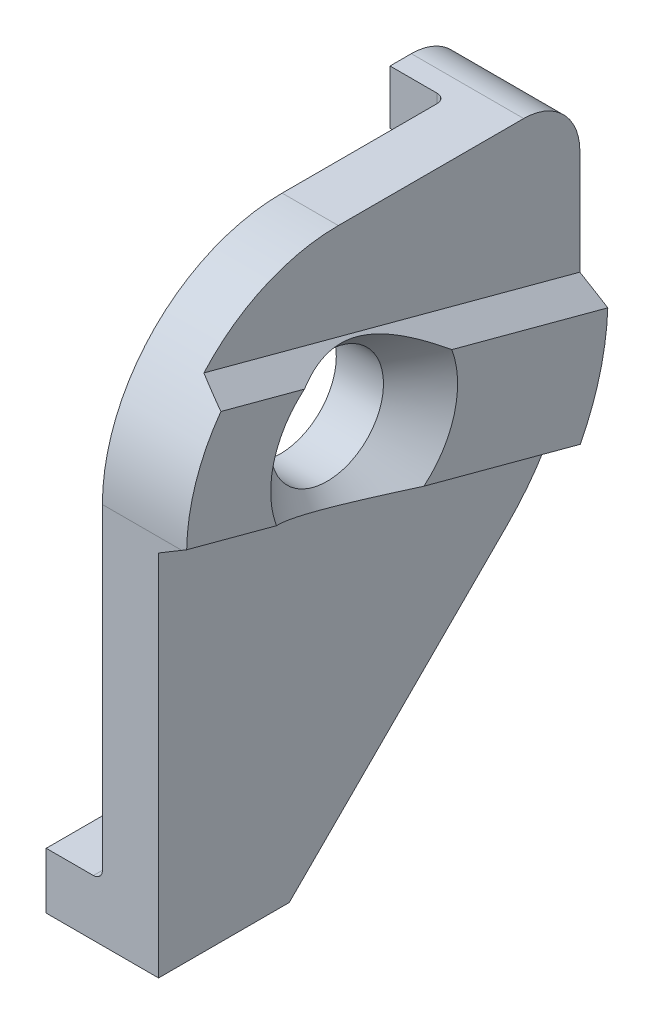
SolidWorks part; units mm, degrees
ref_plane "Спереди" through (0, 0, 0) normal (0, 0, 1) x (1, 0, 0)
ref_plane "Сверху" through (0, 0, 0) normal (0, 1, 0) x (1, 0, 0)
ref_plane "Справа" through (0, 0, 0) normal (1, 0, 0) x (0, 0, -1)
sketch "Эскиз1" plane through (0, 0, 0) normal (1, 0, 0) x (0, 0, -1)
  line L0 (-10.033, -22.225) -> (-10.033, -0.635)
  line L1 (0.127, 9.525) -> (10.6045, 9.525)
  line L2 (13.7795, 6.35) -> (13.7795, -0.0109)
  line L3 (9.6878, -9.8892) -> (-2.648, -22.225)
  line L4 (-2.648, -22.225) -> (-10.033, -22.225)
  circle A0 centre (0, 0) radius 3.1877
  arc A1 (-10.033, -0.635) -> (0.127, 9.525) centre (0.127, -0.635) cw
  arc A2 (13.7795, -0.0109) -> (9.6878, -9.8892) centre (-0.1905, -0.0109) cw
  arc A3 (10.6045, 9.525) -> (13.7795, 6.35) centre (10.6045, 6.35) cw
  dimension "D2" = 6.3754
  dimension "D7" = 10.16
  dimension "D8" = 13.97
  dimension "D10" = 3.175
  dimension "D1" = 10.033
  dimension "D3" = 45
  dimension "D4" = 23.8125
  dimension "D5" = 9.525
  dimension "D6" = 31.75
  dimension "D9" = 13.843
extrude "Бобышка-Вытянуть1" add sketch "Эскиз1" along normal blind 3.175
sketch "Эскиз2" plane through (0, 0, 0) normal (-1, 0, 0) x (0, 0, 1)
  line L0 (-10.6045, 9.525) -> (-0.127, 9.525) construction
  line L1 (-9.398, 6.477) -> (-13.777, 6.477)
  line L2 (-9.398, 6.477) -> (-9.398, 9.525)
  line L3 (-9.398, 9.525) -> (-10.6045, 9.525)
  line L5 (10.033, -22.225) -> (6.477, -22.225)
  line L6 (10.033, -22.225) -> (10.033, -19.05)
  line L7 (10.033, -19.05) -> (6.477, -19.05)
  line L8 (6.477, -22.225) -> (6.477, -19.05)
  arc A0 (-10.6045, 9.525) -> (-13.777, 6.477) centre (-10.6045, 6.35) ccw
  arc A1 (-10.6045, 9.525) -> (-13.7795, 6.35) centre (-10.6045, 6.35) ccw construction
  dimension "D2" = 15.875
  dimension "D3" = 6.477
  dimension "D4" = 19.05
  dimension "D5" = 6.477
extrude "Бобышка-Вытянуть2" add sketch "Эскиз2" along normal blind 3.175
fillet "Скругление1" radius 0.508 4 edges at (0, -20.6375, 6.477) (0, -19.05, 8.255)
sketch "Эскиз3" plane through (3.175, 0, 0) normal (1, 0, 0) x (0, 0, -1)
  line L0 (0, 0) -> (-15.6159, 0) construction
  line L1 (11.7528, -7.2579) -> (-10.033, -1.4204)
  line L2 (-17.1863, 4.6051) -> (16.564, -4.4383) construction
  line L3 (-7.4706, 6.1105) -> (13.7795, 0.4165)
  line L4 (13.7795, 0.4165) -> (13.7795, -0.0109)
  line L5 (13.7795, -0.0109) -> (13.7795, 6.35) construction
  line L6 (-10.033, -1.4204) -> (-10.033, -0.635)
  line L7 (-10.033, -0.635) -> (-10.033, -22.225) construction
  arc A0 (9.6878, -9.8892) -> (13.7795, -0.0109) centre (-0.1905, -0.0109) ccw construction
  arc A1 (11.7528, -7.2579) -> (13.7795, -0.0109) centre (-0.1905, -0.0109) ccw
  arc A2 (-10.033, -0.635) -> (-7.4706, 6.1105) centre (0.127, -0.635) cw
  arc A3 (0.127, 9.525) -> (-10.033, -0.635) centre (0.127, -0.635) ccw construction
  circle A4 centre (0, 0) radius 3.1877
  circle A5 centre (0, 0) radius 3.1877 construction
  dimension "D1" = 15
  dimension "D2" = 7.9375
extrude "Бобышка-Вытянуть3" add sketch "Эскиз3" along normal blind 1.5875
chamfer "Фаска1" distance 1.5875 angle 30 2 edges at (4.7625, -4.3392, -0.8599) (4.7625, 3.2635, -3.1544)
sketch "Эскиз4" plane through (0, 0, 0) normal (0, 0, 1) x (1, 0, 0)
  line L0 (0, 0) -> (10.1855, 0) construction
  line L1 (2.667, 3.1877) -> (4.7625, 3.1877)
  line L2 (4.7625, 3.1877) -> (4.7625, 5.2832)
  line L3 (4.7625, 5.2832) -> (2.667, 3.1877)
  line L4 (4.716, 3.1877) -> (0, 3.1877) construction
  line L5 (4.7625, -0.4719) -> (4.7625, 5.3297) construction
  dimension "D1" = 45
  dimension "D2" = 2.667
revolve "Вырез-Повернуть1" cut sketch "Эскиз4" angle 360 about L0
